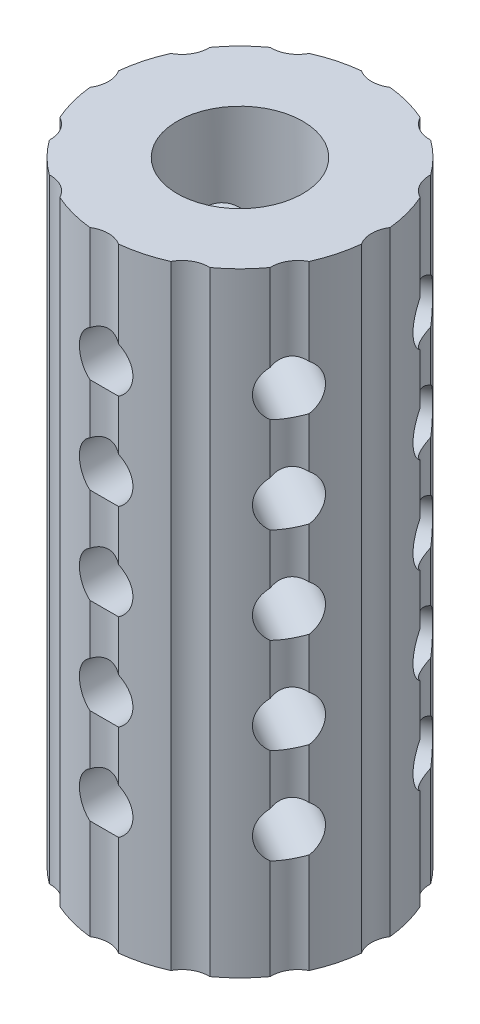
SolidWorks part; units mm, degrees
ref_plane "Front" through (0, 0, 0) normal (0, 0, 1) x (1, 0, 0)
ref_plane "Top" through (0, 0, 0) normal (0, 1, 0) x (1, 0, 0)
ref_plane "Right" through (0, 0, 0) normal (1, 0, 0) x (0, 0, -1)
sketch "Sketch1" plane through (0, 0, 0) normal (0, 0, 1) x (1, 0, 0)
  line L0 (0, -0.1378) -> (0, 23.7963) construction
  line L1 (0, 0) -> (0, 2.54)
  line L2 (0, 2.54) -> (2.921, 2.54)
  line L3 (2.921, 2.54) -> (2.921, 28.575)
  line L4 (2.921, 28.575) -> (6.35, 28.575)
  line L5 (6.35, 28.575) -> (6.35, 0)
  line L6 (6.35, 0) -> (0, 0)
  line L7 (1.651, 2.54) -> (2.921, 2.54) construction
  line L8 (2.921, 2.54) -> (2.921, 0) construction
  line L9 (1.651, 2.54) -> (1.651, 0) construction
  line L10 (0, 5.715) -> (0, 10.16) construction
  line L11 (0, 10.16) -> (0, 14.605) construction
  line L12 (0, 5.715) -> (0, 1.27) construction
  line L13 (0, 1.27) -> (0, 2.54) construction
  line L14 (0, 23.495) -> (0, 19.05) construction
  line L15 (0, 19.05) -> (0, 14.605) construction
  circle A0 centre (0, 5.715) radius 1.5875 construction
  circle A1 centre (0, 10.16) radius 1.5875 construction
  circle A2 centre (0, 14.605) radius 1.5875 construction
  circle A3 centre (0, 19.05) radius 1.5875 construction
  circle A4 centre (0, 23.495) radius 1.5875 construction
  point P10 (2.286, 2.54)
  point P19 (2.286, 2.54)
  dimension "D6" = 3.175
  dimension "D1" = 5.842
  dimension "D2" = 2.54
  dimension "D3" = 3.429
  dimension "D4" = 28.575
  dimension "D5" = 1.27
  dimension "D7" = 4.445
  dimension "D8" = 1.27
  dimension "D9" = 0
  dimension "D10" = 12.7
revolve "Revolve1" add sketch "Sketch1" angle 360 about L0
sketch "Sketch2" plane through (0, 2.54, 0) normal (0, 1, 0) x (1, 0, 0)
  point P0 (2.286, 0)
hole_wizard "#40 (0.098) Diameter Hole2" positions "Sketch2" profile "Sketch3" hole size "#40" standard "ANSI Inch"
sketch "Sketch3" plane through (2.286, 2.54, 0) normal (1, 0, 0) x (0, 0, 1)
  line L0 (0, 0) -> (0, 2.54)
  line L1 (0, 2.54) -> (1.2446, 2.54)
  line L2 (1.2446, 2.54) -> (1.2446, 0)
  line L5 (1.2446, 0) -> (0, 0)
  line L11 (0, -6.35) -> (0, 107.95) construction
  dimension "Thru Hole Dia." = 2.4892
  dimension "Thru Hole Depth" = 2.54
sketch "Sketch4" plane through (0, 0, 0) normal (0, 0, 1) x (1, 0, 0)
  line L0 (0, -200000.1378) -> (0, 200023.7963) construction
  point P0 (0, 5.715)
  point P4 (0, 10.16)
  point P6 (0, 14.605)
  point P16 (0, 19.05)
  point P18 (0, 23.495)
hole_wizard "#40 (0.098) Diameter Hole1" positions "Sketch4" profile "Sketch5" hole size "#40" standard "ANSI Inch"
sketch "Sketch5" plane through (0, 5.715, 0) normal (1, 0, 0) x (0, 1, 0)
  line L0 (0, 0) -> (0, 6.35)
  line L1 (0, 6.35) -> (1.2446, 6.35)
  line L2 (1.2446, 6.35) -> (1.2446, 0)
  line L5 (1.2446, 0) -> (0, 0)
  line L11 (0, -6.35) -> (0, 107.95) construction
  dimension "Thru Hole Dia." = 2.4892
  dimension "Thru Hole Depth" = 6.35
pattern_circular "CirPattern1" count 4 over 360 about axis through (0, 0, 0) along (0, 1, 0) of "#40 (0.098) Diameter Hole2"
pattern_circular "CirPattern2" count 6 over 360 about axis through (0, -0.1378, 0) along (0, 1, 0) of "#40 (0.098) Diameter Hole1"
sketch "Sketch6" plane through (0, 0, 0) normal (0, -1, 0) x (-1, 0, 0)
  point P0 (-7.366, 0)
  point P3 (-7.3113, 0)
  dimension "D1" = 1.016
hole_wizard "#40 (0.098) Diameter Hole3" positions "Sketch6" profile "Sketch7" hole size "#40" standard "ANSI Inch"
sketch "Sketch7" plane through (7.366, 0, 0) normal (1, 0, 0) x (0, 0, -1)
  line L0 (0, 0) -> (0, 28.575)
  line L1 (0, 28.575) -> (1.2446, 28.575)
  line L2 (1.2446, 28.575) -> (1.2446, 0)
  line L5 (1.2446, 0) -> (0, 0)
  line L11 (0, -6.35) -> (0, 107.95) construction
  dimension "Thru Hole Dia." = 2.4892
  dimension "Thru Hole Depth" = 28.575
pattern_circular "CirPattern3" count 12 over 360 about axis through (0, 0, 0) along (0, 1, 0) of "#40 (0.098) Diameter Hole3"
